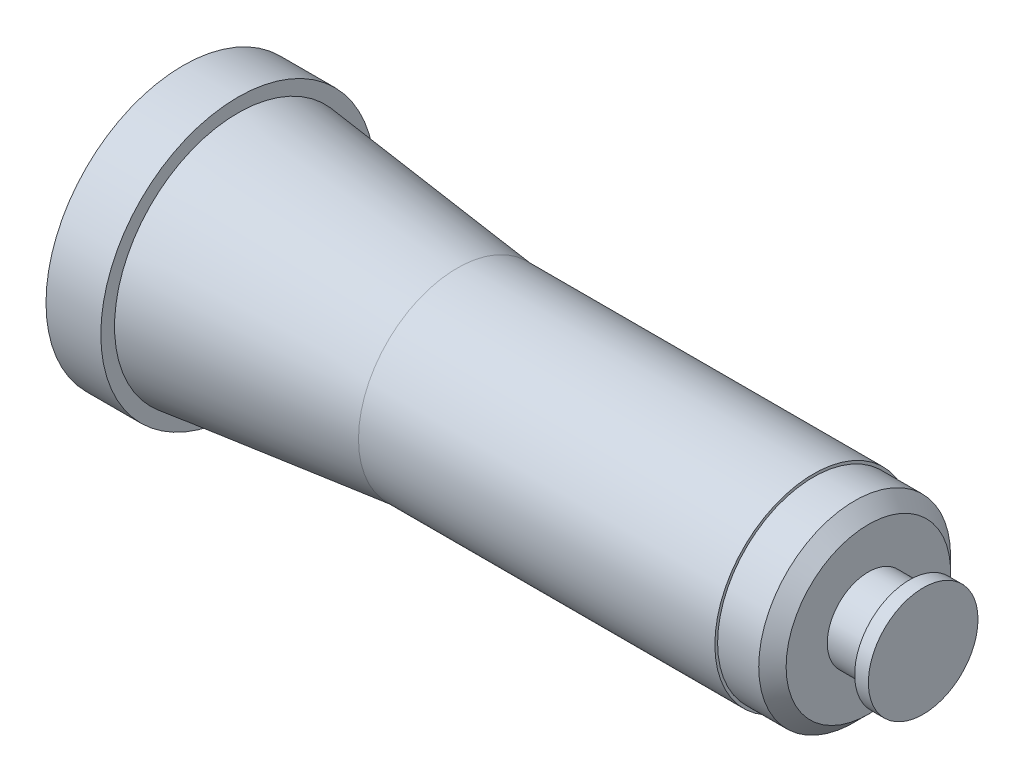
SolidWorks part; units mm, degrees
ref_plane "Plan1" through (0, 0, 0) normal (0, 0, 1) x (1, 0, 0)
ref_plane "Plan2" through (0, 0, 0) normal (0, 1, 0) x (1, 0, 0)
ref_plane "Plan3" through (0, 0, 0) normal (1, 0, 0) x (0, 0, -1)
sketch "Esquisse1" plane through (0, 0, 0) normal (0, 0, 1) x (1, 0, 0)
  line L0 (0, 0) -> (0, -2)
  line L1 (0, -2) -> (-0.5, -2)
  line L2 (-0.5, -2) -> (-0.5, -1.5)
  line L3 (-0.5, -1.5) -> (-2, -1.5)
  line L4 (-2, -1.5) -> (-2, -3.5)
  line L5 (-2, -3.5) -> (-4, -3.5)
  line L7 (-4, -3.6) -> (-17, -3.6)
  line L8 (-17, -3.6) -> (-25, -4.5)
  line L9 (-25, -4.5) -> (-25, -5)
  line L10 (-25, -5) -> (-27, -5)
  line L11 (-27, -5) -> (-27, -3.5)
  line L12 (0, 0) -> (-50, 0) construction
  line L13 (-13.4019, -1.5) -> (-4, -1.5)
  line L14 (-4, -1.5) -> (-4, 0)
  line L15 (-4, 0) -> (0, 0)
  line L16 (-17.7065, -2.4674) -> (-27, -3.5)
  line L17 (-4, -3.5) -> (-4, -3.6)
  arc A0 (-17.7065, -2.4674) -> (-13.4019, -1.5) centre (-16, 0) ccw
  dimension "D18" = 6
  dimension "D19" = 11
  dimension "D15" = 3.5
  dimension "D1" = 2
  dimension "D2" = 0.5
  dimension "D3" = 4
  dimension "D4" = 1.5
  dimension "D5" = 2
  dimension "D6" = 0.5
  dimension "D7" = 0.1
  dimension "D9" = 13
  dimension "D10" = 8
  dimension "D11" = 0.5
  dimension "D12" = 2
  dimension "D13" = 1.5
  dimension "D14" = 1.5
  dimension "D16" = 9.2935
  dimension "D17" = 1.0326
  dimension "D20" = 2
revolve "Base-Révolution" add sketch "Esquisse1" angle 360 about L12
chamfer "Chanfrein1" distance 0.5 angle 45
